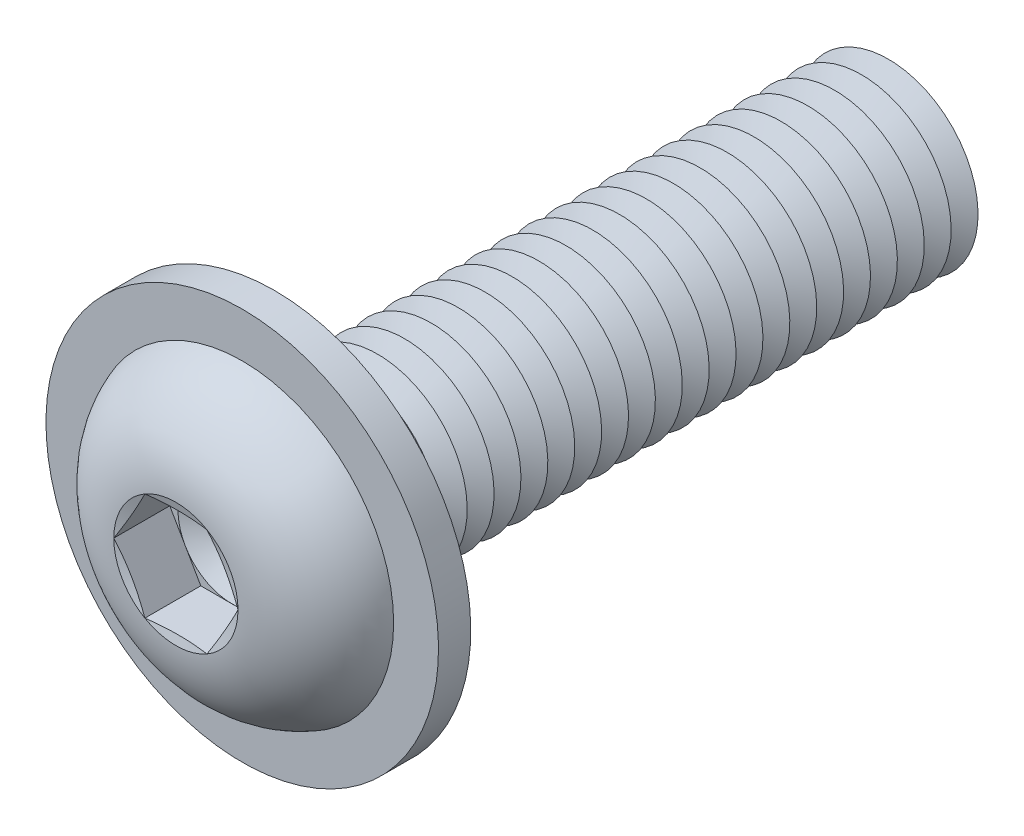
SolidWorks part; units mm, degrees
ref_plane "Front Plane" through (0, 0, 0) normal (0, 0, 1) x (1, 0, 0)
ref_plane "Top Plane" through (0, 0, 0) normal (0, 1, 0) x (1, 0, 0)
ref_plane "Right Plane" through (0, 0, 0) normal (1, 0, 0) x (0, 0, -1)
sketch "Sketch1" plane through (0, 0, 0) normal (1, 0, 0) x (0, 0, -1)
  line L0 (0, 5) -> (0, 8.75)
  line L3 (0, 5) -> (35, 5)
  line L4 (35, 5) -> (35, 0)
  line L5 (35, 0) -> (-5.5, 0) construction
  line L6 (-5.5, 0) -> (35, 0)
  line L7 (-5.5, 3.4641) -> (-5.5, 1.732) construction
  line L8 (-5.5, 1.732) -> (-5.5, 0)
  line L9 (-5.5, 3.4641) -> (-5.0359, 1.732)
  line L10 (-5.0359, 1.732) -> (-5.5, 1.732)
  line L11 (35, 0) -> (22.7481, 0) construction
  line L12 (0, 8.75) -> (-5.5, 8.75) construction
  arc A1 (0, 8.75) -> (-5.5, 3.4641) centre (0, 3.2457) ccw
  point P8 (35, 2.5)
  dimension "D1" = 17.5
  dimension "D2" = 10
  dimension "D3" = 5.5
  dimension "D4" = 6.9282
  dimension "D5" = 35
  dimension "D6" = 15
revolve "Revolve1" add sketch "Sketch1" angle 360 about L5
fillet "Fillet1" radius 0.75 1 edges at (0, 5, 0)
sketch "Sketch2" plane through (0, 0, 0) normal (1, 0, 0) x (0, 0, -1)
  line L0 (34.25, 5) -> (35.75, 5)
  line L1 (35, 5) -> (0.75, 5) construction
  line L2 (35.75, 5) -> (35, 3.701)
  line L3 (35, -5) -> (35, 5) construction
  line L4 (35, 3.701) -> (34.25, 5)
  dimension "D1" = 1.5
revolve "Cut-Revolve1" cut sketch "Sketch2" angle 360 about axis through (0, 0, -35) along (0, 0, -1)
pattern_linear "LPattern1" count 23 spacing 1.5 along (0, 0, 1) of "Cut-Revolve1"
sketch "Sketch3" plane through (0, 0, 5.5) normal (0, 0, 1) x (1, 0, 0)
  line L7 (1.732, 3) -> (-1.7321, 3)
  line L8 (-1.7321, 3) -> (-3.4641, 0)
  line L9 (-3.4641, 0) -> (-1.732, -3)
  line L10 (-1.732, -3) -> (1.732, -3)
  line L11 (1.732, -3) -> (3.4641, 0)
  line L12 (3.4641, 0) -> (1.732, 3)
  circle A0 centre (0, 0) radius 3 construction
  circle A3 centre (0, 0) radius 3.4641 construction
extrude "Cut-Extrude1" cut sketch "Sketch3" against normal blind 3.12
sketch "Sketch4" plane through (0, 0, 2.38) normal (0, 0, 1) x (1, 0, 0)
  line L1 (1.732, 3) -> (-1.7321, 3) construction
  circle A0 centre (0, 0) radius 3
extrude "Cut-Extrude2" cut sketch "Sketch4" against normal through all draft 60
sketch "Sketch5" plane through (0, 0, 0) normal (0, 0, -1) x (-1, 0, 0)
  circle A0 centre (0, 0) radius 10.95
  circle A1 centre (0, 0) radius 5.75
  circle A2 centre (0, 0) radius 5.75 construction
  dimension "D1" = 21.9
extrude "Boss-Extrude1" add sketch "Sketch5" against normal blind 1.8
